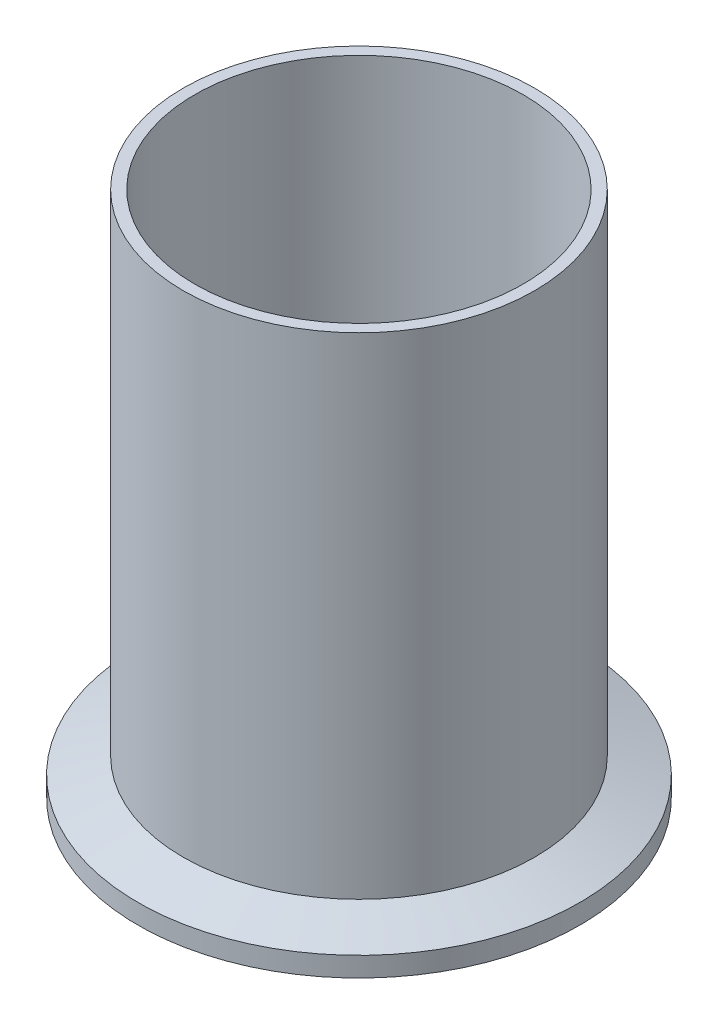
SolidWorks part; units mm, degrees
ref_plane "Front Plane" through (0, 0, 0) normal (0, 0, 1) x (1, 0, 0)
ref_plane "Top Plane" through (0, 0, 0) normal (0, 1, 0) x (1, 0, 0)
ref_plane "Right Plane" through (0, 0, 0) normal (1, 0, 0) x (0, 0, -1)
sketch "Sketch1" plane through (0, 0, 0) normal (0, 0, 1) x (1, 0, 0)
  line L0 (0, 0) -> (0, 76.2) construction
  line L1 (0, 76.2) -> (-25.4, 76.2)
  line L2 (-25.4, 76.2) -> (-25.4, 5.23)
  line L3 (-25.4, 5.23) -> (-31.9532, 2.8448)
  line L4 (-31.9532, 2.8448) -> (-31.9532, 0)
  line L5 (-31.9532, 0) -> (-29.9866, 0)
  line L6 (-26.3506, 0) -> (0, 0)
  line L7 (0, 0) -> (0, 76.2)
  line L8 (0, 76.2) -> (-23.749, 76.2)
  line L9 (-23.749, 76.2) -> (-23.749, 0)
  line L10 (-23.749, 0) -> (0, 0)
  line L11 (0, 0) -> (-0.1846, 0.0129)
  arc A0 (-29.2641, 0.4745) -> (-27.0731, 0.4745) centre (-28.1686, 0) cw
  arc A1 (-26.3506, 0) -> (-27.0731, 0.4745) centre (-26.3506, 0.7874) cw
  arc A2 (-29.2641, 0.4745) -> (-29.9866, 0) centre (-29.9866, 0.7874) cw
  point P12 (-26.9748, 0)
  dimension "D6" = 1.1938
  dimension "D7" = 0.7874
  dimension "D1" = 25.4
  dimension "D2" = 2.8448
  dimension "D3" = 31.9532
  dimension "D4" = 70
  dimension "D5" = 28.1686
  dimension "D8" = 1.651
  dimension "D9" = 76.2
revolve "Revolve2" add sketch "Sketch1" angle 360 about L0
